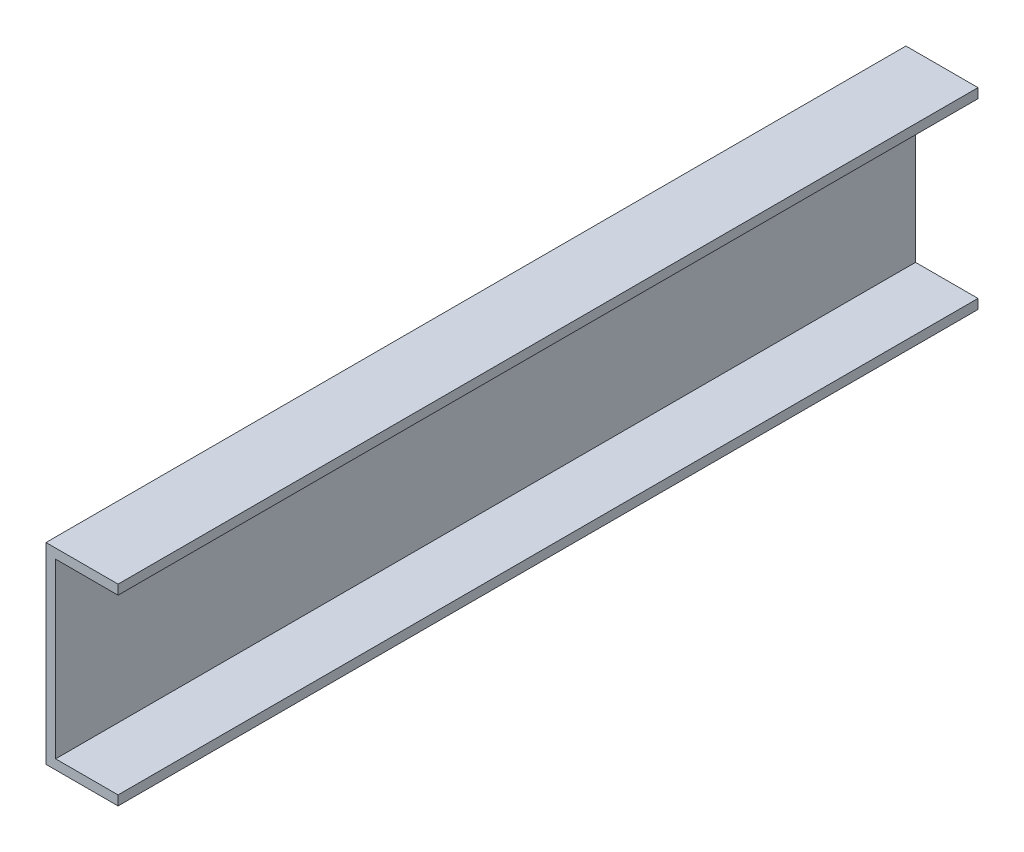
SolidWorks part; units mm, degrees
ref_plane "Front Plane" through (0, 0, 0) normal (0, 0, 1) x (1, 0, 0)
ref_plane "Top Plane" through (0, 0, 0) normal (0, 1, 0) x (1, 0, 0)
ref_plane "Right Plane" through (0, 0, 0) normal (1, 0, 0) x (0, 0, -1)
sketch "Sketch1" plane through (0, 0, 0) normal (0, 0, 1) x (1, 0, 0)
  line L0 (75, 0) -> (0, 0)
  line L1 (0, 0) -> (0, 200)
  line L2 (0, 200) -> (75, 200)
  line L3 (75, 200) -> (75, 190)
  line L4 (75, 190) -> (10, 190)
  line L5 (10, 190) -> (10, 10)
  line L6 (10, 10) -> (75, 10)
  line L7 (75, 10) -> (75, 0)
  dimension "D1" = 200
  dimension "D2" = 75
  dimension "D3" = 10
  dimension "D4" = 10
extrude "Boss-Extrude1" add sketch "Sketch1" along normal mid plane 895
